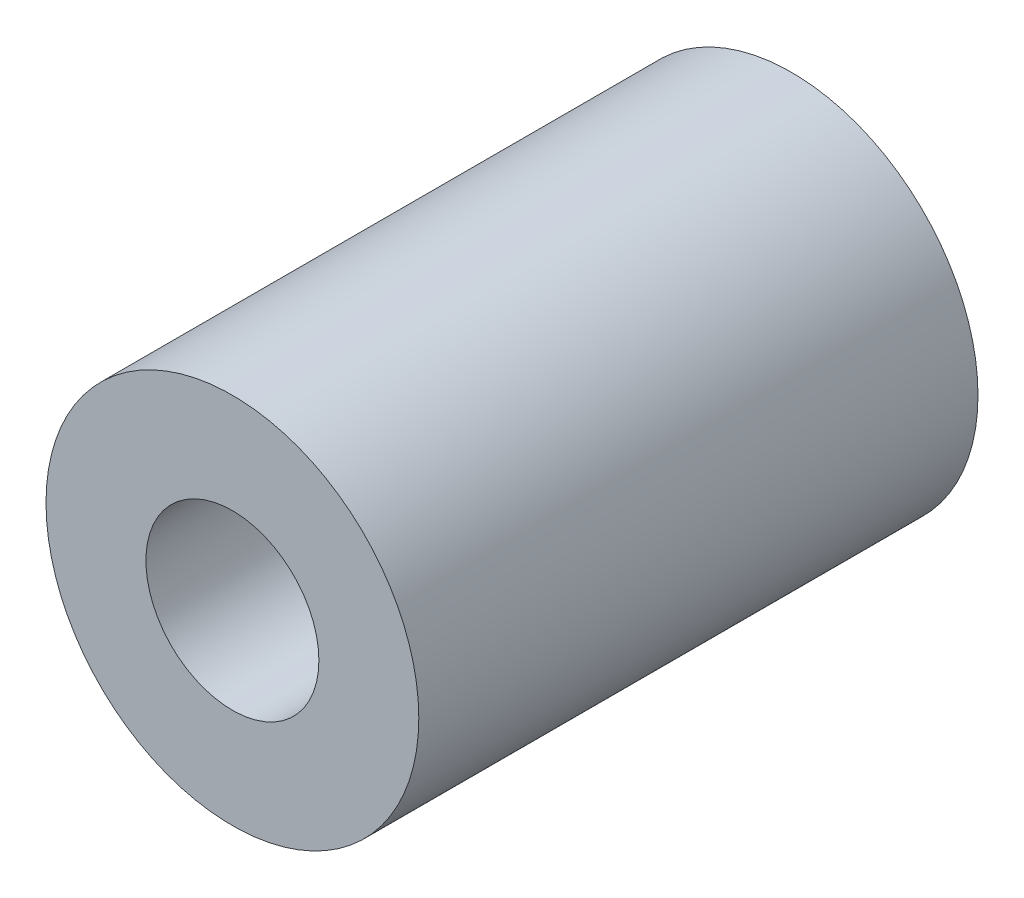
SolidWorks part; units mm, degrees
ref_plane "Front Plane" through (0, 0, 0) normal (0, 0, 1) x (1, 0, 0)
ref_plane "Top Plane" through (0, 0, 0) normal (0, 1, 0) x (1, 0, 0)
ref_plane "Right Plane" through (0, 0, 0) normal (1, 0, 0) x (0, 0, -1)
sketch "Sketch1" plane through (0, 0, 0) normal (0, 0, 1) x (1, 0, 0)
  circle A0 centre (0, 0) radius 3.175
  dimension "D1" = 6.35
extrude "Boss-Extrude1" add sketch "Sketch1" along normal blind 9.525
hole_wizard "#4 Clearance Hole1" positions "Sketch3" profile "Sketch2" hole size "#4" standard "ANSI Inch"
sketch "Sketch3" plane through (0, 0, 9.525) normal (0, 0, 1) x (1, 0, 0)
  point P0 (0, 0)
sketch "Sketch2" plane through (0, 0, 9.525) normal (1, 0, 0) x (0, -1, 0)
  line L0 (0, 0) -> (0, 9.525)
  line L1 (0, 9.525) -> (1.4732, 9.525)
  line L2 (1.4732, 9.525) -> (1.4732, 0)
  line L5 (1.4732, 0) -> (0, 0)
  line L11 (0, -6.35) -> (0, 107.95) construction
  dimension "Thru Hole Dia." = 2.9464
  dimension "Thru Hole Depth" = 9.525
